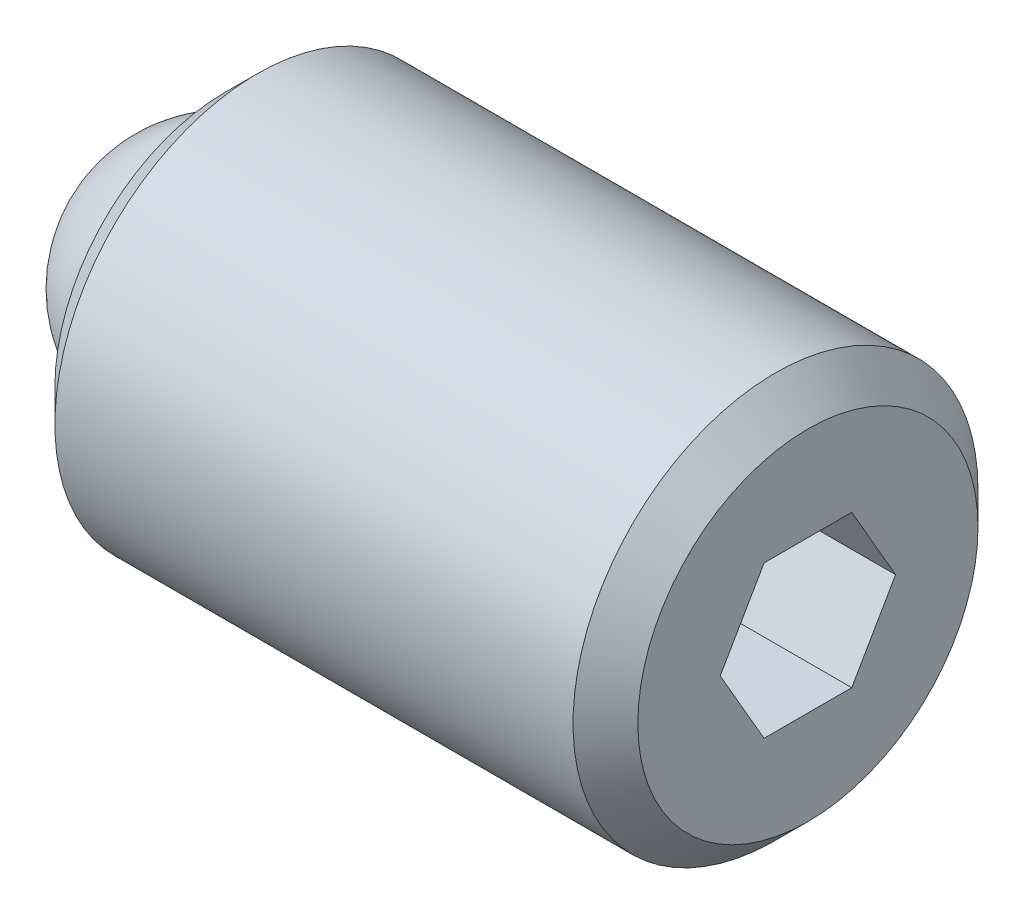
SolidWorks part; units mm, degrees
ref_plane "Front Plane" through (0, 0, 0) normal (0, 0, 1) x (1, 0, 0)
ref_plane "Top Plane" through (0, 0, 0) normal (0, 1, 0) x (1, 0, 0)
ref_plane "Right Plane" through (0, 0, 0) normal (1, 0, 0) x (0, 0, -1)
sketch "Sketch2" plane through (0, 0, 0) normal (1, 0, 0) x (0, 0, -1)
  circle A0 centre (0, 0) radius 3.175
  dimension "D1" = 6.35
extrude "Boss-Extrude1" add sketch "Sketch2" along normal blind 9.1408
sketch "Sketch3" plane through (0, 0, 0) normal (-1, 0, 0) x (0, 0, 1)
  circle A0 centre (0, 0) radius 1.9812
  dimension "D1" = 3.9624
chamfer "Chamfer1" distance 0.508 angle 45 1 edges at (0, 0, -3.175)
chamfer "Chamfer2" distance 0.508 angle 45 1 edges at (9.1408, 0, -3.175)
sketch "Sketch4" plane through (9.1408, 0, 0) normal (1, 0, 0) x (0, 0, -1)
  line L1 (1.3748, 0) -> (0.6874, 1.1906)
  line L2 (0.6874, 1.1906) -> (-0.6874, 1.1906)
  line L3 (-0.6874, 1.1906) -> (-1.3748, 0)
  line L4 (-1.3748, 0) -> (-0.6874, -1.1906)
  line L5 (-0.6874, -1.1906) -> (0.6874, -1.1906)
  line L6 (0.6874, -1.1906) -> (1.3748, 0)
  circle A0 centre (0, 0) radius 1.1906 construction
  dimension "D1" = 2.3813
extrude "Cut-Extrude2" cut sketch "Sketch4" against normal blind 2.286
extrude "Cut-Extrude3" cut sketch "Sketch3" against normal blind 1.9844
sketch "Sketch5" plane through (0, 0, 0) normal (-1, 0, 0) x (0, 0, 1)
  line L0 (0, 0) -> (0, -1.9844)
  line L1 (0, 0) -> (0, 1.9844)
  arc A0 (0, 1.9844) -> (0, -1.9844) centre (0, 0) ccw
  dimension "D1" = 1.9844
revolve "Revolve1" add sketch "Sketch5" angle 360 about L1
